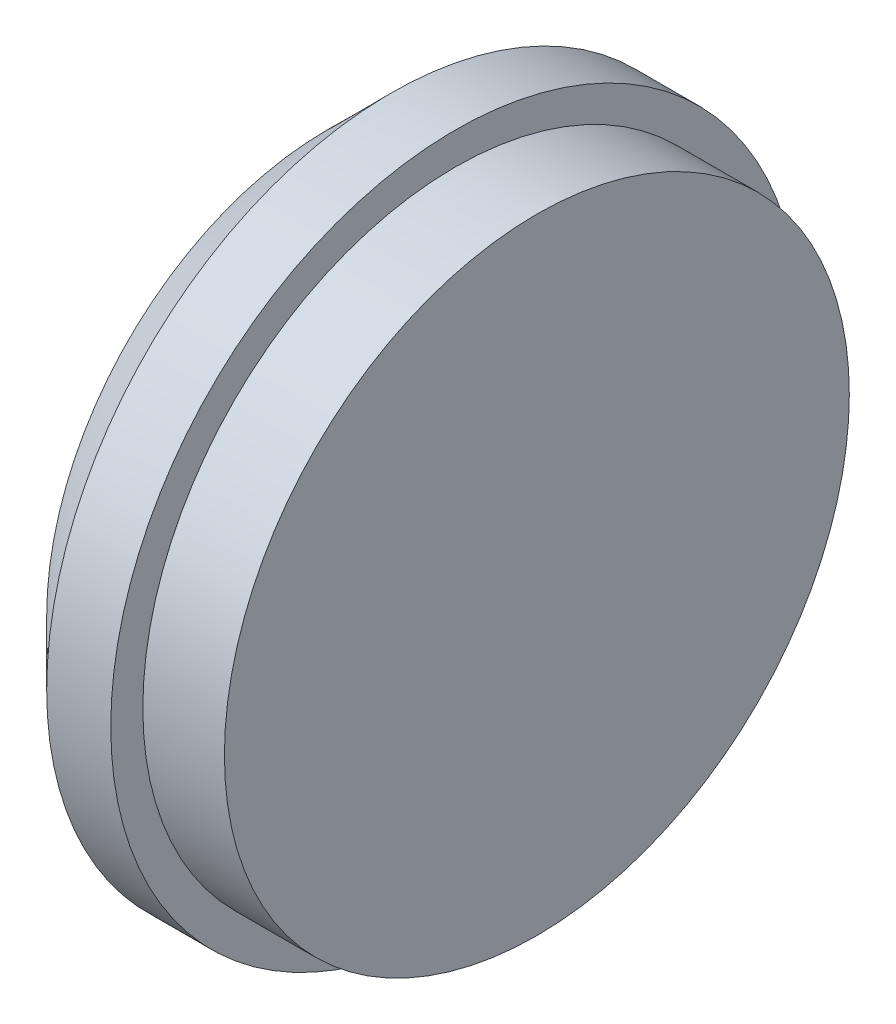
SolidWorks part; units mm, degrees
ref_plane "Front Plane" through (0, 0, 0) normal (0, 0, 1) x (1, 0, 0)
ref_plane "Top Plane" through (0, 0, 0) normal (0, 1, 0) x (1, 0, 0)
ref_plane "Right Plane" through (0, 0, 0) normal (1, 0, 0) x (0, 0, -1)
sketch "Sketch1" plane through (0, 0, 0) normal (0, 0, 1) x (1, 0, 0)
  line L1 (-6.3475, 17.8283) -> (-6.3475, -3.4569)
  line L2 (-6.3475, -3.4569) -> (-11.905, -3.4569)
  line L3 (-11.905, -3.4569) -> (-11.905, -5.6413)
  line L4 (-11.905, -5.6413) -> (-16.2712, -5.6413)
  line L5 (-16.2712, -5.6413) -> (-20.635, -1.2776)
  line L6 (-20.635, -1.2776) -> (-20.635, 17.8283)
  line L7 (-20.635, 17.8283) -> (-6.3475, 17.8283)
  dimension "D1" = 21.2852
  dimension "D2" = 45
  dimension "D3" = 5.5575
  dimension "D4" = 4.3663
  dimension "D5" = 14.2875
  dimension "D6" = 23.4696
revolve "Revolve1" add sketch "Sketch1" angle 360 about L7
